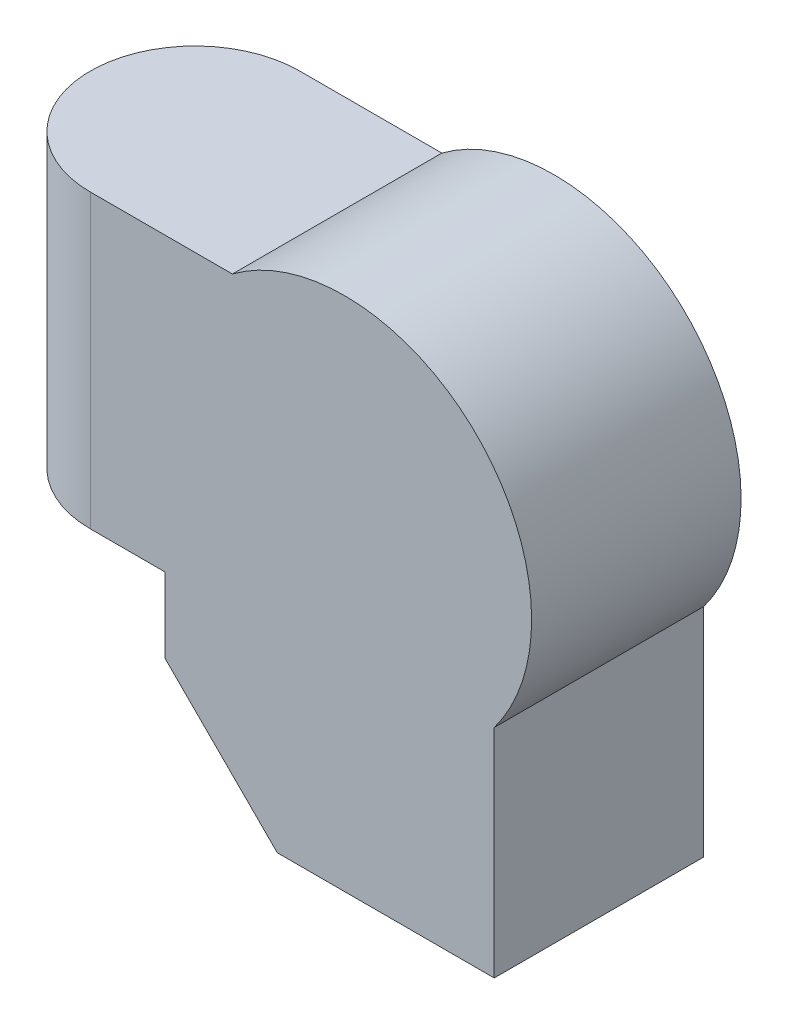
SolidWorks part; units mm, degrees
ref_plane "Plan de face" through (0, 0, 0) normal (0, 0, 1) x (1, 0, 0)
ref_plane "Plan de dessus" through (0, 0, 0) normal (0, 1, 0) x (1, 0, 0)
ref_plane "Plan de droite" through (0, 0, 0) normal (1, 0, 0) x (0, 0, -1)
sketch "Esquisse1" plane through (0, 0, 0) normal (0, 0, 1) x (1, 0, 0)
  line L0 (0, 0) -> (0, -44) construction
  line L1 (20, -44) -> (20, -15)
  line L2 (20, -44) -> (-9, -44)
  line L3 (-48, 20) -> (-15, 20)
  line L4 (-48, 20) -> (-48, -19)
  line L8 (-48, -19) -> (-24, -19)
  line L9 (-24, -19) -> (-24, -29)
  line L10 (-24, -29) -> (-9, -44)
  line L11 (-34, 20) -> (-34, -19) construction
  arc A0 (20, -15) -> (-15, 20) centre (0, 0) ccw
  dimension "D1" = 50
  dimension "D5" = 39
  dimension "D2" = 44
  dimension "D3" = 20
  dimension "D4" = 44
  dimension "D6" = 20
  dimension "D10" = 48
  dimension "D11" = 15
  dimension "D12" = 15
  dimension "D13" = 34
extrude "Extrusion1" add sketch "Esquisse1" along normal blind 28
sketch "Esquisse2" plane through (0, 20, 0) normal (0, 1, 0) x (-1, 0, 0)
  line L0 (48, 28) -> (48, 0) construction
  line L1 (15, 0) -> (48, 0) construction
  line L2 (34, 28) -> (34, 34)
  line L3 (34, 34) -> (50, 34)
  line L4 (50, 34) -> (50, -6)
  line L5 (50, -6) -> (34, -6)
  line L6 (34, -6) -> (34, 0)
  arc A0 (34, 0) -> (34, 28) centre (34, 14) ccw
  dimension "D1" = 28
  dimension "D2" = 16
  dimension "D3" = 40
extrude "Enlèv. mat.-Extru.1" cut sketch "Esquisse2" against normal through all
